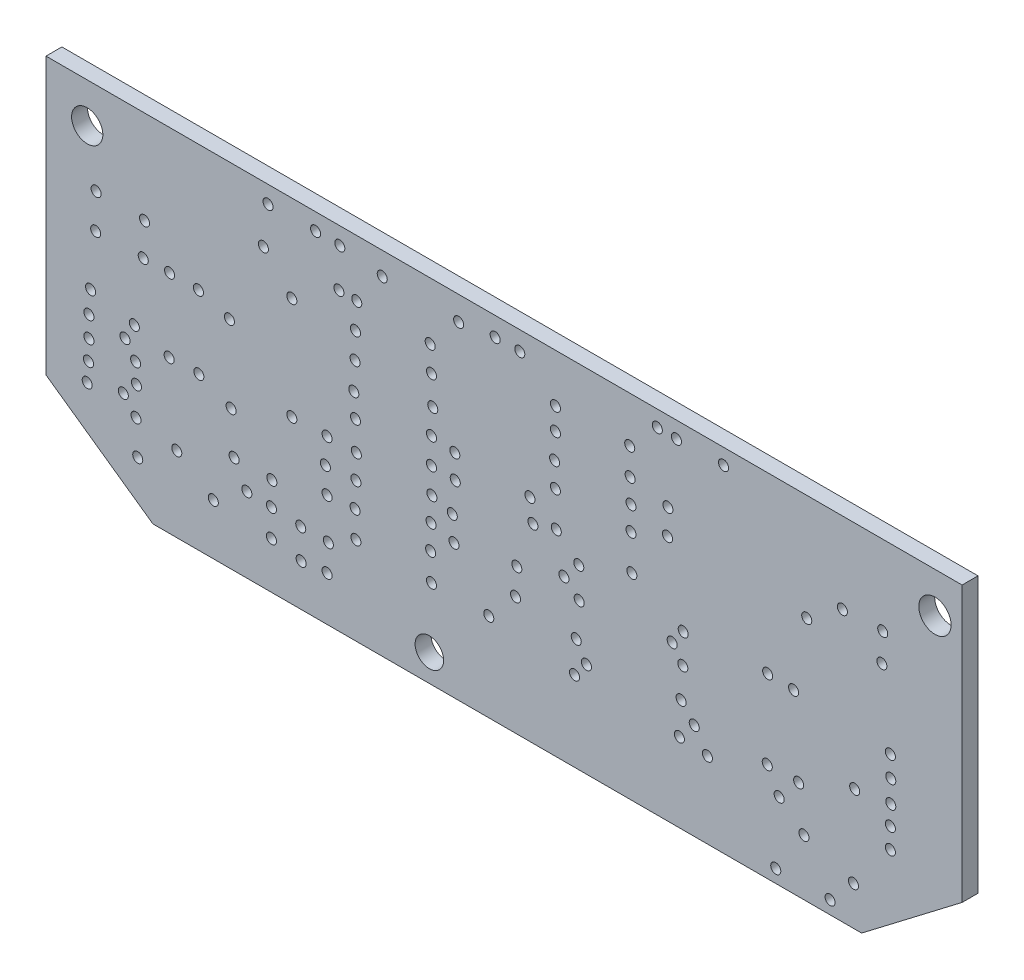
SolidWorks part; units mm, degrees
ref_plane "Face" through (0, 0, 0) normal (0, 0, 1) x (1, 0, 0)
ref_plane "Dessus" through (0, 0, 0) normal (0, 1, 0) x (1, 0, 0)
ref_plane "Droite" through (0, 0, 0) normal (1, 0, 0) x (0, 0, -1)
sketch "Esquisse1" plane through (0, 0, 0) normal (0, 0, 1) x (1, 0, 0)
  line L0 (-30.7312, 13.5571) -> (60.3857, 13.5571)
  line L1 (60.3857, 13.5571) -> (60.3857, -13.7864)
  line L2 (60.3857, -13.7864) -> (50.3916, -21.4225)
  line L3 (50.3916, -21.4225) -> (-20.0991, -21.4225)
  line L4 (-20.0991, -21.4225) -> (-30.7312, -13.913)
  line L5 (-30.7312, -13.913) -> (-30.7312, 13.5571)
  circle A0 centre (13.9422, 11.6729) radius 0.5
  circle A1 centre (16.391, 11.6729) radius 0.5
  circle A2 centre (10.3112, 11.1662) radius 0.5
  circle A3 centre (2.7115, 11.2929) radius 0.5
  circle A4 centre (0.1782, 7.9152) radius 0.5
  circle A5 centre (-1.5951, 7.9574) radius 0.5
  circle A6 centre (0.0515, 5.2975) radius 0.5
  circle A7 centre (0.0093, 2.722) radius 0.5
  circle A8 centre (7.4824, 7.873) radius 0.5
  circle A9 centre (7.6091, 5.3819) radius 0.5
  circle A10 centre (7.7358, 2.5531) radius 0.5
  circle A11 centre (7.6091, 0.0199) radius 0.5
  circle A12 centre (7.6091, -2.5556) radius 0.5
  circle A13 centre (7.6513, -5.0889) radius 0.5
  circle A14 centre (7.5669, -7.4955) radius 0.5
  circle A15 centre (7.5246, -9.9443) radius 0.5
  circle A16 centre (9.9312, -0.2757) radius 0.5
  circle A17 centre (9.9735, -2.64) radius 0.5
  circle A18 centre (9.6779, -5.68) radius 0.5
  circle A19 centre (9.8468, -8.0865) radius 0.5
  circle A20 centre (17.4043, -0.3601) radius 0.5
  circle A21 centre (17.6999, -2.5134) radius 0.5
  circle A22 centre (19.9376, 8.7596) radius 0.5
  circle A23 centre (19.9376, 6.5641) radius 0.5
  circle A24 centre (19.8532, 4.0309) radius 0.5
  circle A25 centre (19.9376, 1.6243) radius 0.5
  circle A26 centre (20.022, -1.8378) radius 0.5
  circle A27 centre (22.2598, -3.78) radius 0.5
  circle A28 centre (20.782, -5.5111) radius 0.5
  circle A29 centre (22.302, -6.8199) radius 0.5
  circle A30 centre (16.0955, -6.9888) radius 0.5
  circle A31 centre (15.9688, -9.6487) radius 0.5
  circle A32 centre (22.0064, -10.282) radius 0.5
  circle A33 centre (27.3263, 9.0129) radius 0.5
  circle A34 centre (27.3685, 6.353) radius 0.5
  circle A35 centre (27.4529, 4.0309) radius 0.5
  circle A36 centre (27.4529, 1.6665) radius 0.5
  circle A37 centre (27.5374, -1.8378) radius 0.5
  circle A38 centre (31.1262, 5.6353) radius 0.5
  circle A39 centre (31.0839, 3.102) radius 0.5
  circle A40 centre (32.6461, -4.3289) radius 0.5
  circle A41 centre (31.5484, -5.8066) radius 0.5
  circle A42 centre (32.6039, -7.2843) radius 0.5
  circle A43 centre (32.435, -10.3243) radius 0.5
  circle A44 centre (7.6091, -12.6464) radius 0.5
  circle A45 centre (7.398, -18.7262) radius 1.4186
  circle A46 centre (0.0938, -12.6886) radius 0.5
  circle A47 centre (0.0093, -10.0709) radius 0.5
  circle A48 centre (0.0938, -7.5799) radius 0.5
  circle A49 centre (-2.9461, -7.791) radius 0.5
  circle A50 centre (-2.7773, -10.282) radius 0.5
  circle A51 centre (-2.6506, -14.293) radius 0.5
  circle A52 centre (-5.395, -14.293) radius 0.5
  circle A53 centre (-8.3082, -14.0819) radius 0.5
  circle A54 centre (-8.266, -11.7175) radius 0.5
  circle A55 centre (-12.0237, -11.6753) radius 0.5
  circle A56 centre (-10.757, -13.9553) radius 0.5
  circle A57 centre (-5.3527, -17.2485) radius 0.5
  circle A58 centre (-2.7773, -16.9952) radius 0.5
  circle A59 centre (-8.3082, -16.7841) radius 0.5
  circle A60 centre (-14.0925, -16.3619) radius 0.5
  circle A61 centre (-17.7235, -13.913) radius 0.5
  circle A62 centre (-21.6078, -16.4463) radius 0.5
  circle A63 centre (-21.7767, -13.1108) radius 0.5
  circle A64 centre (-23.0433, -11.6331) radius 0.5
  circle A65 centre (-21.7345, -10.2398) radius 0.5
  circle A66 centre (-21.8189, -8.2977) radius 0.5
  circle A67 centre (-22.8744, -6.8199) radius 0.5
  circle A68 centre (-21.9456, -5.2155) radius 0.5
  circle A69 centre (-18.4835, -6.271) radius 0.5
  circle A70 centre (-15.528, -6.2288) radius 0.5
  circle A71 centre (-12.3192, -7.5799) radius 0.5
  circle A72 centre (-6.2816, -5.3) radius 0.5
  circle A73 centre (-2.7773, -5.2155) radius 0.5
  circle A74 centre (0.136, -5.1733) radius 0.5
  circle A75 centre (-12.4881, 0.0199) radius 0.5
  circle A76 centre (-15.5702, 0.991) radius 0.5
  circle A77 centre (-18.4412, 1.0332) radius 0.5
  circle A78 centre (-21.0589, 0.991) radius 0.5
  circle A79 centre (-20.9323, 4.2842) radius 0.5
  circle A80 centre (-25.7455, 4.4109) radius 0.5
  circle A81 centre (-25.7877, 0.9487) radius 0.5
  circle A82 centre (-6.2816, 4.9175) radius 0.5
  circle A83 centre (-9.1104, 7.9574) radius 0.5
  circle A84 centre (-26.2943, -4.3289) radius 0.5
  circle A85 centre (-26.4632, -6.5666) radius 0.5
  circle A86 centre (-26.4632, -8.6354) radius 0.5
  circle A87 centre (-26.5054, -10.6198) radius 0.5
  circle A88 centre (-26.6321, -12.5197) radius 0.5
  circle A89 centre (-26.6321, 9.604) radius 1.5536
  circle A90 centre (0.0515, -2.3023) radius 0.5
  circle A91 centre (13.3089, -12.6464) radius 0.5
  circle A92 centre (21.8375, -13.4486) radius 0.5
  circle A93 centre (23.0197, -11.9709) radius 0.5
  circle A94 centre (33.7439, -11.8442) radius 0.5
  circle A95 centre (32.2661, -13.5753) radius 0.5
  circle A96 centre (35.0527, -13.8286) radius 0.5
  circle A97 centre (41.8503, -20.1195) radius 0.5
  circle A98 centre (47.2546, -20.1195) radius 0.5
  circle A99 centre (44.6545, -15.8546) radius 0.5
  circle A100 centre (42.188, -13.7864) radius 0.5
  circle A101 centre (41.0059, -11.5909) radius 0.5
  circle A102 centre (44.1302, -11.5909) radius 0.5
  circle A103 centre (43.6236, -3.8645) radius 0.5
  circle A104 centre (41.0481, -3.7378) radius 0.5
  circle A105 centre (44.9324, 2.9753) radius 0.5
  circle A106 centre (48.479, 5.5086) radius 0.5
  circle A107 centre (52.49, 5.6353) radius 0.5
  circle A108 centre (52.4055, 2.8065) radius 0.5
  circle A109 centre (53.2499, -4.5822) radius 0.5
  circle A110 centre (53.2922, -6.651) radius 0.5
  circle A111 centre (53.2922, -8.8465) radius 0.5
  circle A112 centre (53.2499, -10.7887) radius 0.5
  circle A113 centre (53.2499, -12.8153) radius 0.5
  circle A114 centre (49.7034, -9.3532) radius 0.5
  circle A115 centre (49.5767, -17.544) radius 0.5
  circle A116 centre (30.0706, 11.9684) radius 0.5
  circle A117 centre (31.9706, 11.9262) radius 0.5
  circle A118 centre (36.6571, 12.0106) radius 0.5
  circle A119 centre (-1.5106, 11.8417) radius 0.5
  circle A120 centre (-3.9172, 11.884) radius 0.5
  circle A121 centre (-8.646, 11.8417) radius 0.5
  circle A122 centre (-0.1173, -0.0223) radius 0.5
  circle A123 centre (57.6831, 9.5618) radius 1.6066
extrude "Extrusion1" add sketch "Esquisse1" along normal blind 1.58
sketch "Esquisse2" plane through (0, 0, 1.58) normal (0, 0, 1) x (1, 0, 0)
  point P0 (-26.6321, 9.604)
  point P1 (7.398, -18.7262)
  point P3 (57.6831, 9.5618)
